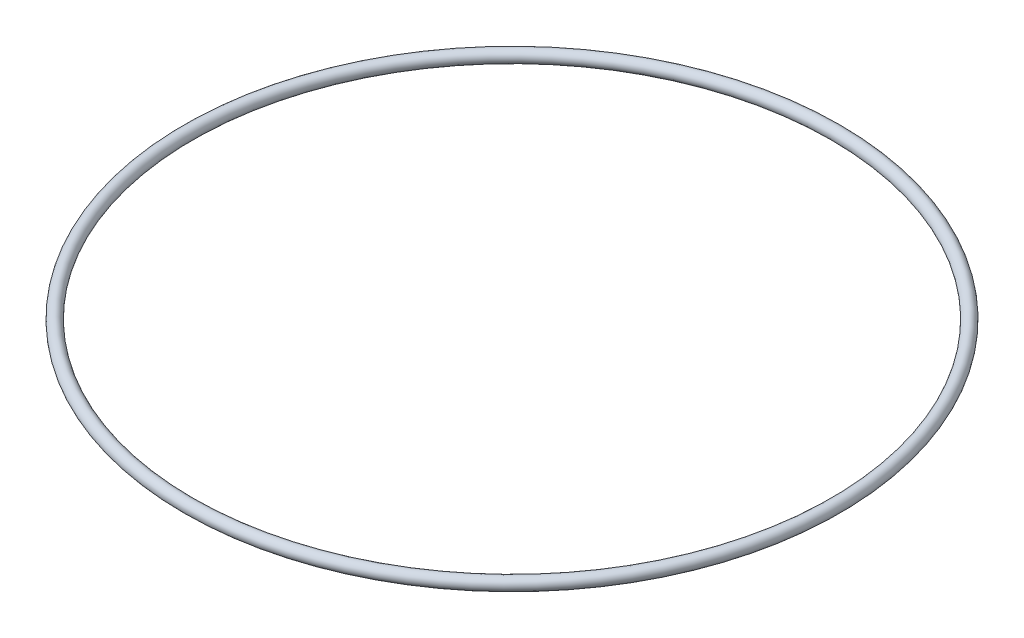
SolidWorks part; units mm, degrees
ref_plane "Plan1" through (0, 0, 0) normal (0, 0, 1) x (1, 0, 0)
ref_plane "Plan2" through (0, 0, 0) normal (0, 1, 0) x (1, 0, 0)
ref_plane "Plan3" through (0, 0, 0) normal (1, 0, 0) x (0, 0, -1)
sketch "Esquisse1" plane through (0, 0, 0) normal (0, 0, 1) x (1, 0, 0)
  line L1 (0, 0) -> (257.5, 0) construction
  line L2 (0, 2.5) -> (0, -2.5) construction
  circle A0 centre (131.25, 0) radius 2.5
  dimension "D2" = 131.25
  dimension "D1" = 5
  dimension "Diamètre du tore" = 5
  dimension "Diamètre intérieur" = 257.5
revolve "Base-Révolution" add sketch "Esquisse1" angle 360 about L2
equation " \"D1@Esquisse1\"=\"Diamètre du tore@Esquisse1\" "
equation "\"D2@Esquisse1\" = (\"Diamètre intérieur@Esquisse1\"/2)+(\"Diamètre du tore@Esquisse1\"/2)"
